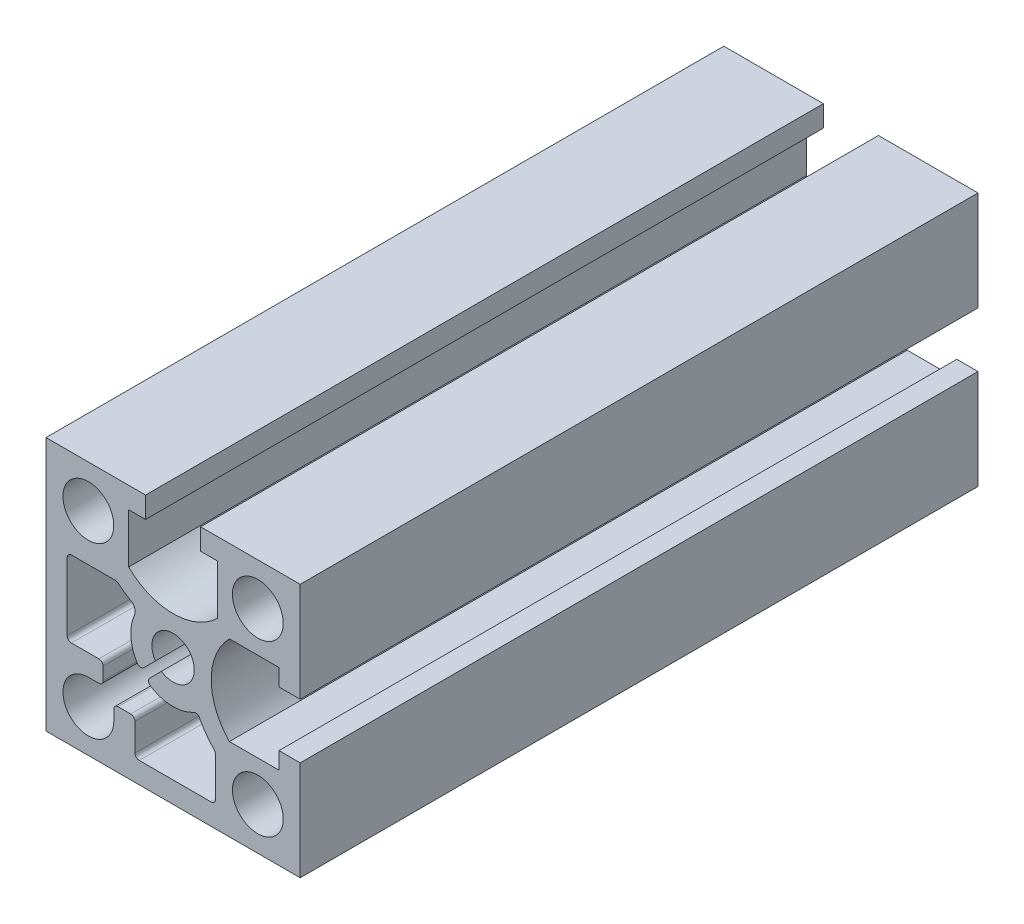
SolidWorks part; units mm, degrees
ref_plane "前基準面" through (0, 0, 0) normal (0, 0, 1) x (1, 0, 0)
ref_plane "上基準面" through (0, 0, 0) normal (0, 1, 0) x (1, 0, 0)
ref_plane "右基準面" through (0, 0, 0) normal (1, 0, 0) x (0, 0, -1)
sketch "草圖1" plane through (0, 0, 0) normal (0, 0, 1) x (1, 0, 0)
  line L0 (0, 18) -> (0, 0) construction
  line L1 (0, 0) -> (18, 0) construction
  line L2 (0, 0) -> (-15, -15) construction
  line L3 (-15, 15) -> (-3.25, 15)
  line L4 (-15, 15) -> (-15, -15)
  line L5 (-15, -15) -> (15, -15)
  line L6 (15, -15) -> (15, -3.25)
  line L7 (12.5, -5.25) -> (6.6439, -5.25)
  line L8 (-3.25, 15) -> (-3.25, 12.5)
  line L9 (-3.25, 12.5) -> (-5.25, 12.5)
  line L10 (-5.25, 12.5) -> (-5.25, 6.6439)
  line L11 (15, -3.25) -> (12.5, -3.25)
  line L12 (12.5, -3.25) -> (12.5, -5.25)
  line L13 (5.25, 12.5) -> (5.25, 6.6439)
  line L14 (3.25, 12.5) -> (5.25, 12.5)
  line L15 (3.25, 15) -> (3.25, 12.5)
  line L16 (12.5, 3.25) -> (12.5, 5.25)
  line L17 (15, 3.25) -> (12.5, 3.25)
  line L18 (12.5, 5.25) -> (6.6439, 5.25)
  line L19 (3.25, 15) -> (15, 15)
  line L20 (15, 15) -> (15, 3.25)
  line L21 (-8.7619, -4.5) -> (-12, -4.5)
  line L22 (-6.8007, 4.5) -> (-12, 4.5)
  line L23 (-2.0856, -1.3785) -> (-3.456, -2.7489)
  line L24 (-12.5, 4) -> (-12.5, -4)
  line L25 (-1.3785, -2.0856) -> (-2.7489, -3.456)
  line L26 (-8.2619, -6.5) -> (-8.2619, -5)
  line L27 (-10, -7) -> (-8.7619, -7)
  line L28 (5, -12) -> (5, -7.3485)
  line L29 (-0.3536, 0.3536) -> (-15.3536, -14.6464) construction
  line L30 (0.3536, -0.3536) -> (-14.6464, -15.3536) construction
  line L31 (-6.5, -8.2619) -> (-5, -8.2619)
  line L32 (-4.5, -8.7619) -> (-4.5, -12)
  line L33 (-7, -10) -> (-7, -8.7619)
  line L34 (-4, -12.5) -> (4.5, -12.5)
  arc A0 (-5.25, 6.6439) -> (5.25, 6.6439) centre (0, 12) ccw
  arc A1 (6.6439, -5.25) -> (6.6439, 5.25) centre (12, 0) cw
  circle A2 centre (10, 10) radius 3
  circle A3 centre (10, -10) radius 3
  arc A4 (-10, -7) -> (-7, -10) centre (-10, -10) ccw
  circle A5 centre (-10, 10) radius 3
  arc A6 (-1.3785, -2.0856) -> (-2.0856, -1.3785) centre (0, 0) ccw
  arc A7 (-2.6615, -4.2328) -> (2.4242, -4.373) centre (0, 0) ccw
  arc A8 (-6.4769, 4.381) -> (-4.9757, 3.3258) centre (0, 12) ccw
  arc A9 (-7, 4.8586) -> (7, 4.8586) centre (0, 12) ccw construction
  circle A10 centre (0, 0) radius 5 construction
  circle A11 centre (0, 0) radius 2.5 construction
  arc A12 (-2.6615, -4.2328) -> (-2.7489, -3.456) centre (-2.3953, -3.8095) cw
  arc A13 (-3.456, -2.7489) -> (-4.2328, -2.6615) centre (-3.8095, -2.3953) cw
  arc A14 (-8.7619, -7) -> (-8.2619, -6.5) centre (-8.7619, -6.5) ccw
  arc A15 (-8.2619, -5) -> (-8.7619, -4.5) centre (-8.7619, -5) ccw
  arc A16 (-12, -4.5) -> (-12.5, -4) centre (-12, -4) cw
  arc A17 (-12.5, 4) -> (-12, 4.5) centre (-12, 4) cw
  arc A18 (-6.8007, 4.5) -> (-6.4769, 4.381) centre (-6.8007, 4) cw
  arc A19 (-4.9757, 3.3258) -> (-4.5611, 2.0486) centre (-5.4733, 2.4583) cw
  arc A20 (-4.5611, 2.0486) -> (-4.2328, -2.6615) centre (0, 0) ccw
  arc A21 (-5, -8.2619) -> (-4.5, -8.7619) centre (-5, -8.7619) cw
  arc A22 (-4.5, -12) -> (-4, -12.5) centre (-4, -12) ccw
  arc A23 (-6.5, -8.2619) -> (-7, -8.7619) centre (-6.5, -8.7619) ccw
  arc A24 (4.8571, -6.9985) -> (3.1111, -4.5812) centre (12, 0) cw
  arc A25 (4.8586, -7) -> (4.8586, 7) centre (12, 0) cw construction
  arc A27 (5, -12) -> (4.5, -12.5) centre (4.5, -12) cw
  arc A28 (2.4242, -4.373) -> (3.1111, -4.5812) centre (2.6667, -4.8103) cw
  arc A29 (4.8571, -6.9985) -> (5, -7.3485) centre (4.5, -7.3485) cw
  point P64 (-12.5, -4.5)
  point P67 (-12.5, 4.5)
  point P74 (-4.0908, 2.875)
  dimension "D8" = 7.5
  dimension "D12" = 6
  dimension "D14" = 20
  dimension "D15" = 5
  dimension "D21" = 0.5
  dimension "D22" = 1
  dimension "D24" = 0.5
  dimension "D26" = 0.5
  dimension "D27" = 0.5
  dimension "D1" = 18
  dimension "D2" = 30
  dimension "D3" = 3
  dimension "D4" = 30
  dimension "D5" = 15
  dimension "D6" = 15
  dimension "D7" = 10.5
  dimension "D9" = 10.5
  dimension "D10" = 6.5
  dimension "D11" = 2.5
  dimension "D13" = 20
  dimension "D18" = 5.5
  dimension "D23" = 2.5
  dimension "D25" = 5
  dimension "D28" = 2.5
  dimension "D16" = 2.5
  dimension "D17" = 2.5
  dimension "D19" = 0.5
  dimension "D20" = 1
extrude "填料-伸長1" add sketch "草圖1" along normal mid plane 80
